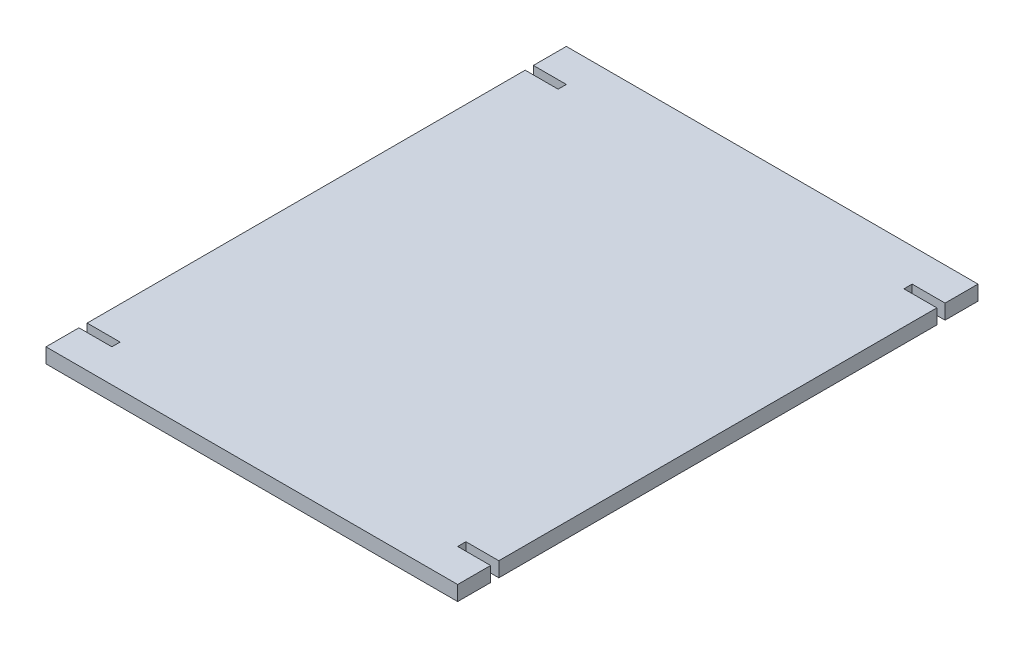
SolidWorks part; units mm, degrees
ref_plane "Front Plane" through (0, 0, 0) normal (0, 0, 1) x (1, 0, 0)
ref_plane "Top Plane" through (0, 0, 0) normal (0, 1, 0) x (1, 0, 0)
ref_plane "Right Plane" through (0, 0, 0) normal (1, 0, 0) x (0, 0, -1)
sketch "Sketch1" plane through (0, 0, 0) normal (0, 1, 0) x (1, 0, 0)
  line L0 (-301.875, 208.2292) -> (198.125, 208.2292)
  line L1 (198.125, 208.2292) -> (198.125, 168.2292)
  line L2 (198.125, 168.2292) -> (158.125, 168.2292)
  line L3 (158.125, 168.2292) -> (158.125, 158.2292)
  line L4 (158.125, 158.2292) -> (198.125, 158.2292)
  line L5 (198.125, 158.2292) -> (198.125, -373.7708)
  line L6 (198.125, -373.7708) -> (158.125, -373.7708)
  line L7 (158.125, -373.7708) -> (158.125, -383.7708)
  line L8 (158.125, -383.7708) -> (198.125, -383.7708)
  line L9 (198.125, -383.7708) -> (198.125, -423.7708)
  line L10 (198.125, -423.7708) -> (-301.875, -423.7708)
  line L11 (-301.875, -423.7708) -> (-301.875, -383.7708)
  line L12 (-301.875, -383.7708) -> (-261.875, -383.7708)
  line L13 (-261.875, -383.7708) -> (-261.875, -373.7708)
  line L14 (-261.875, -373.7708) -> (-301.875, -373.7708)
  line L15 (-301.875, -373.7708) -> (-301.875, 158.2292)
  line L16 (-301.875, 158.2292) -> (-261.875, 158.2292)
  line L17 (-261.875, 158.2292) -> (-261.875, 168.2292)
  line L18 (-261.875, 168.2292) -> (-301.875, 168.2292)
  line L19 (-301.875, 168.2292) -> (-301.875, 208.2292)
  point P18 (-281.875, -383.7708)
  dimension "D1" = 10
  dimension "D2" = 40
  dimension "D3" = 40
  dimension "D4" = 632
  dimension "D5" = 500
  dimension "D6" = 40
extrude "Boss-Extrude1" add sketch "Sketch1" along normal blind 18
